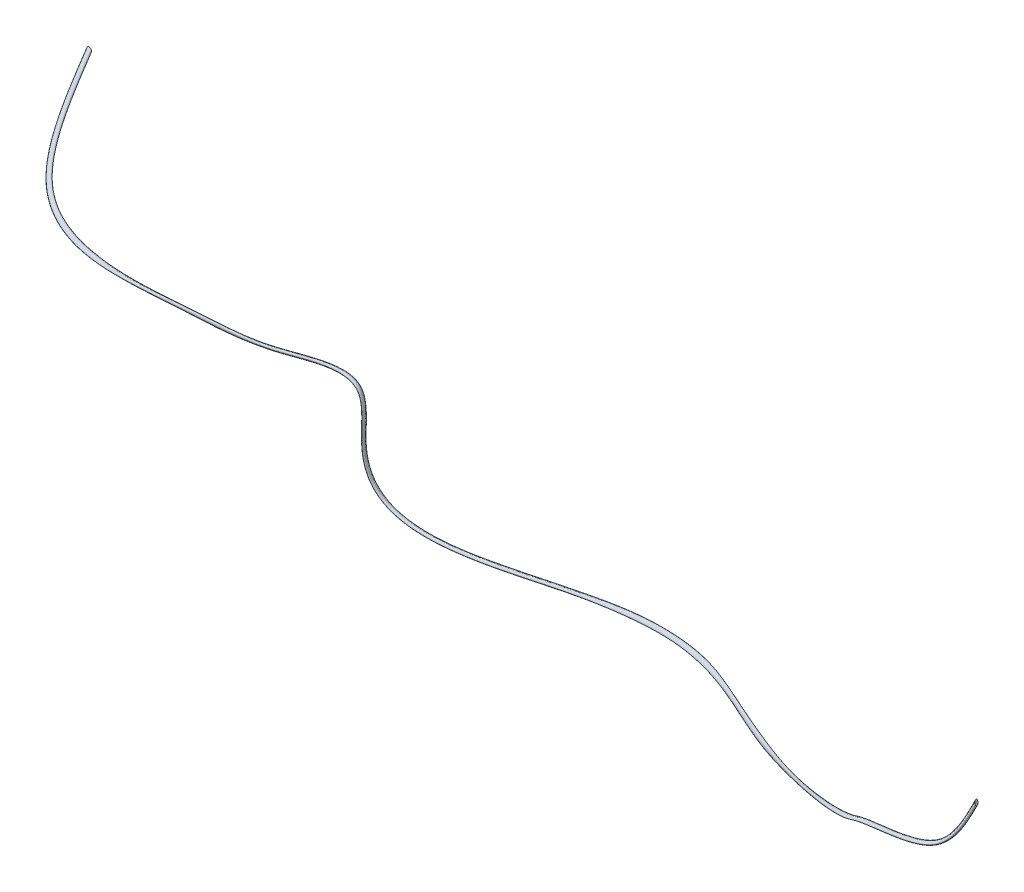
SolidWorks part; units mm, degrees
ref_plane "Plan de face" through (0, 0, 0) normal (0, 0, 1) x (1, 0, 0)
ref_plane "Plan de dessus" through (0, 0, 0) normal (0, 1, 0) x (1, 0, 0)
ref_plane "Plan de droite" through (0, 0, 0) normal (1, 0, 0) x (0, 0, -1)
sketch "Esquisse1" plane through (0, 0, 0) normal (0, 0, 1) x (1, 0, 0)
  circle A0 centre (7.1818, -6.05) radius 0.1534 construction
  circle A1 centre (7.1818, -6.05) radius 0.1534
  point P0 (7.1818, -6.05)
sketch3d "Esquisse3D1"
  spline S0 degree 3 poles (7.1818, -6.05, 0) (7.3676, -7.7827, 1.4822) (7.8922, -12.673, 5.6653) (17.9846, -10.3413, 6.9) (23.5508, -12.1917, 4.7594) (29.7232, -9.9224, 4.5934) (26.8887, -23.2463, 4.0466) (47.1866, -12.7848, 2.6701) (54.8274, -18.234, 5.2522) (58.6055, -20.2036, 4.0907) (60.3844, -19.7543, 3.8238) (63.807, -20.9543, 2.8103) (64.8104, -18.4125, 2.2348) (65.2684, -17.2522, 1.9721) knots 0 0 0 0 0.08918 0.251696 0.312217 0.387134 0.433336 0.746752 0.833191 0.891453 0.891453 0.950452 1 1 1 1
sweep "Balayage1" add profiles "Esquisse1" path "Esquisse3D1"
